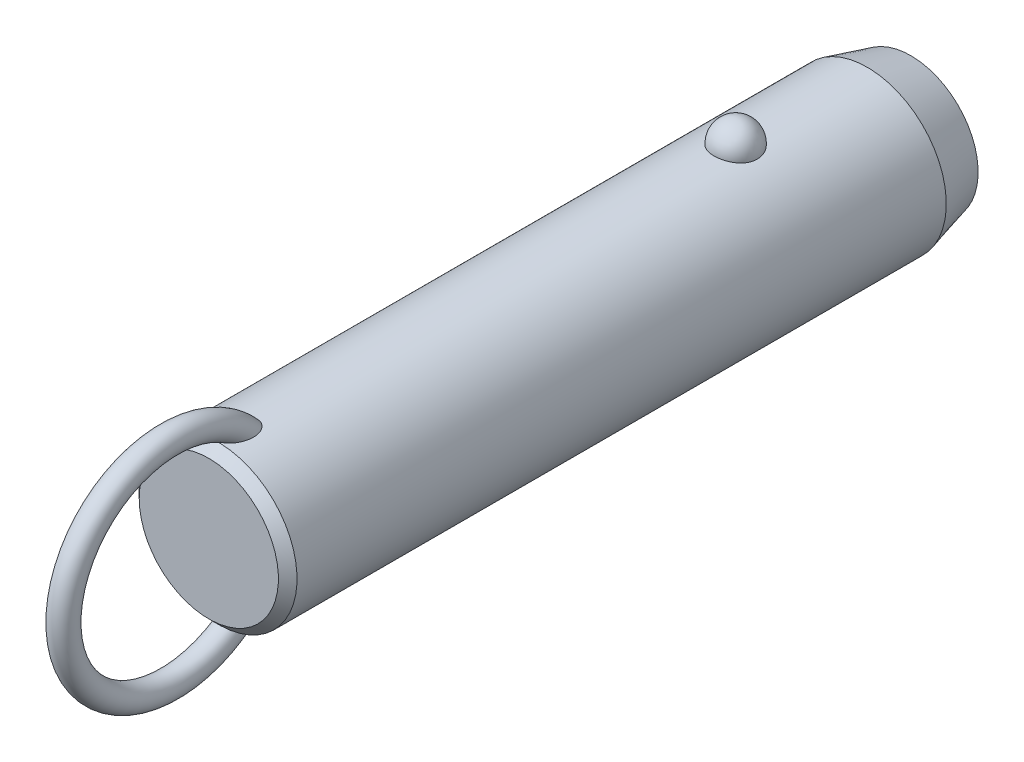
SolidWorks part; units mm, degrees
ref_plane "Front Plane" through (0, 0, 0) normal (0, 0, 1) x (1, 0, 0)
ref_plane "Top Plane" through (0, 0, 0) normal (0, 1, 0) x (1, 0, 0)
ref_plane "Right Plane" through (0, 0, 0) normal (1, 0, 0) x (0, 0, -1)
sketch "Sketch2" plane through (0, 0, 0) normal (0, 0, 1) x (1, 0, 0)
  circle A0 centre (0, 0) radius 12.7
  point P3 (0, 12.7)
  dimension "D1" = 25.4
extrude "Boss-Extrude1" add sketch "Sketch2" along normal blind 68.6
sketch "Sketch3" plane through (0, 0, 0) normal (0, 0, -1) x (-1, 0, 0)
  circle A0 centre (0, 0) radius 12.7
  dimension "D1" = 25.4
extrude "Boss-Extrude2" add sketch "Sketch3" along normal blind 31.7
chamfer "Chamfer1" distance 7 angle 15 1 edges at (-12.7, 0, -31.7)
sketch "Sketch12" plane through (0, 0, 0) normal (1, 0, 0) x (0, 0, -1)
  line L0 (-68.6, 12.7) -> (-68.6, -12.7) construction
  point P0 (-68.6, 0)
sketch "Sketch13" plane through (0, 0, 0) normal (1, 0, 0) x (0, 0, -1)
  circle A0 centre (-87.65, 0) radius 19.05
  point P2 (-68.6, 0)
  dimension "D1" = 38.1
sketch "Sketch14" plane through (0, 0, 0) normal (0, 1, 0) x (1, 0, 0)
  circle A0 centre (0, -70.6) radius 2
  point P2 (0, -68.6)
  dimension "D1" = 4
sweep "Sweep1" add profiles "Sketch14" path "Sketch13"
sketch "Sketch15" plane through (0, 0, 68.6) normal (0, 0, 1) x (1, 0, 0)
  circle A0 centre (0, 0) radius 12.7
  dimension "D1" = 25.4
extrude "Boss-Extrude3" add sketch "Sketch15" along normal blind 12.7
chamfer "Chamfer2" distance 1.5 angle 45 1 edges at (12.7, 0, 81.3)
sketch "Sketch18" plane through (0, 0, 0) normal (1, 0, 0) x (0, 0, -1)
  line L0 (24.7, 12.7) -> (-73.451, 12.7) construction
  line L1 (3.5, 16.2) -> (3.5, 9.2)
  line L2 (-73.451, -12.7) -> (24.7, -12.7) construction
  arc A0 (3.5, 16.2) -> (3.5, 9.2) centre (3.5, 12.7) ccw
  point P4 (0, 12.7)
  dimension "D1" = 28.9
revolve "Revolve1" add sketch "Sketch18" angle 360 about L1
